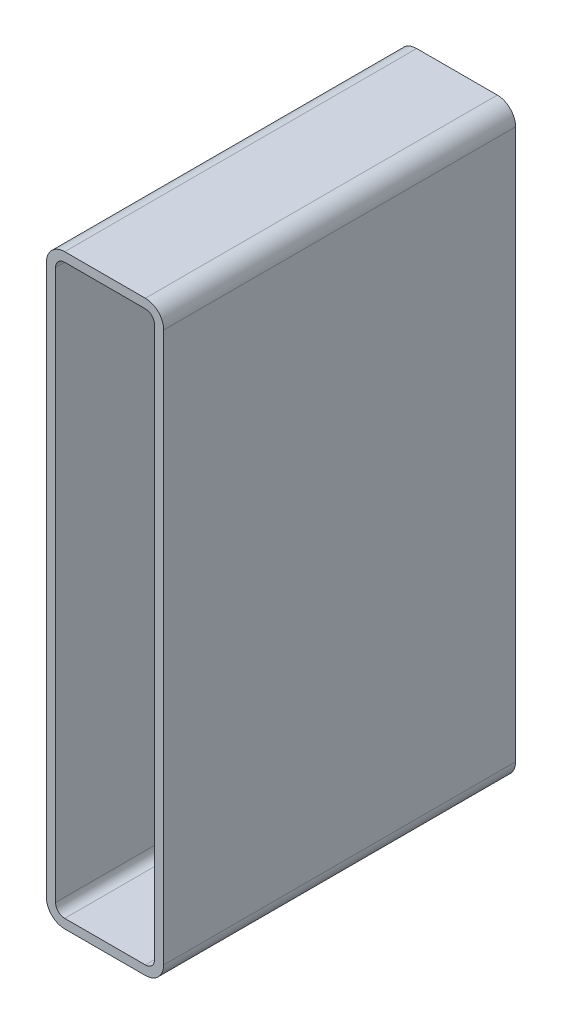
SolidWorks part; units mm, degrees
ref_plane "Front Plane" through (0, 0, 0) normal (0, 0, 1) x (1, 0, 0)
ref_plane "Top Plane" through (0, 0, 0) normal (0, 1, 0) x (1, 0, 0)
ref_plane "Right Plane" through (0, 0, 0) normal (1, 0, 0) x (0, 0, -1)
sketch "Sketch1" plane through (0, 0, 0) normal (0, 0, 1) x (1, 0, 0)
sketch_block_instance "HSS20x4x0.3125-1"
sketch_block "HSS20x4x0.3125"
extrude "Boss-Extrude1" add sketch "Sketch1" along normal blind 304.8
